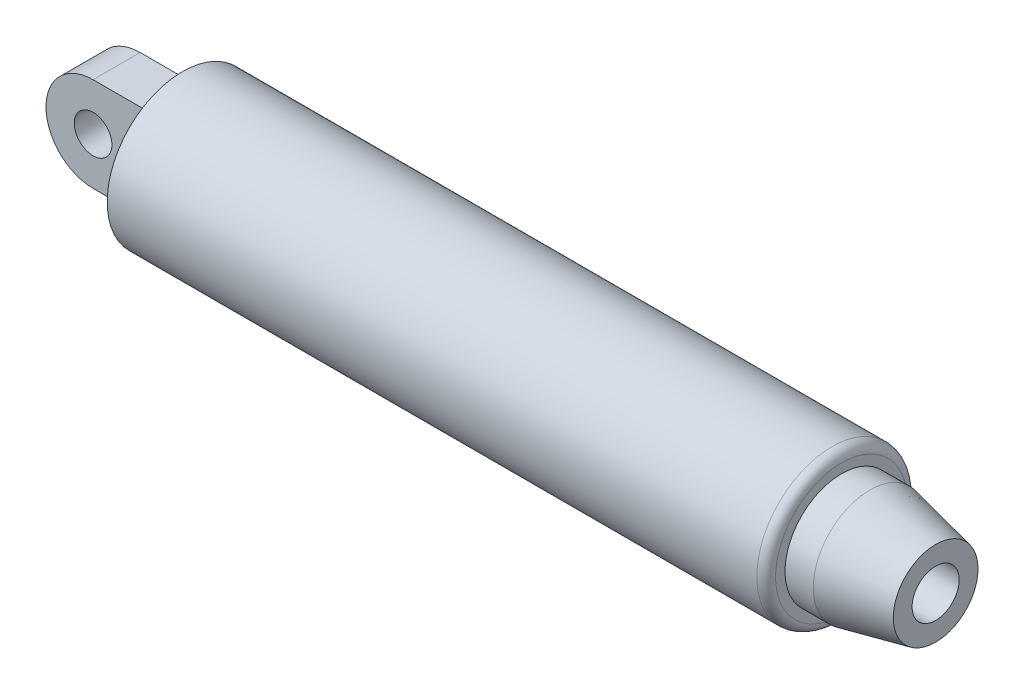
SolidWorks part; units mm, degrees
ref_plane "Plan de face" through (0, 0, 0) normal (0, 0, 1) x (1, 0, 0)
ref_plane "Plan de dessus" through (0, 0, 0) normal (0, 1, 0) x (1, 0, 0)
ref_plane "Plan de droite" through (0, 0, 0) normal (1, 0, 0) x (0, 0, -1)
sketch "Esquisse1" plane through (0, 0, 0) normal (1, 0, 0) x (0, 0, -1)
  circle A0 centre (0, 0) radius 80
extrude "Boss.-Extru.1" add sketch "Esquisse1" along normal blind 700
sketch "Esquisse2" plane through (700, 0, 0) normal (1, 0, 0) x (0, 0, -1)
  circle A0 centre (0, 0) radius 60
extrude "Boss.-Extru.2" add sketch "Esquisse2" along normal blind 100
chamfer "Chanfrein1" distance 70 distance2 15 1 edges at (800, 0, -60)
sketch "Esquisse3" plane through (800, 0, 0) normal (1, 0, 0) x (0, 0, -1)
  circle A0 centre (0, 0) radius 25
extrude "Enlèv. mat.-Extru.1" cut sketch "Esquisse3" against normal blind 400
fillet "Congé1" radius 10 1 edges at (700, 0, -80)
sketch "Esquisse4" plane through (0, 0, 0) normal (0, 0, 1) x (1, 0, 0)
  line L0 (-70, 50) -> (0, 50)
  line L1 (0, 80) -> (0, -80) construction
  line L2 (0, 50) -> (0, -50)
  line L3 (0, -50) -> (-70, -50)
  arc A0 (-70, 50) -> (-70, -50) centre (-70, 0) ccw
  circle A1 centre (-70, 0) radius 20
extrude "Boss.-Extru.3" add sketch "Esquisse4" along normal mid plane 50
